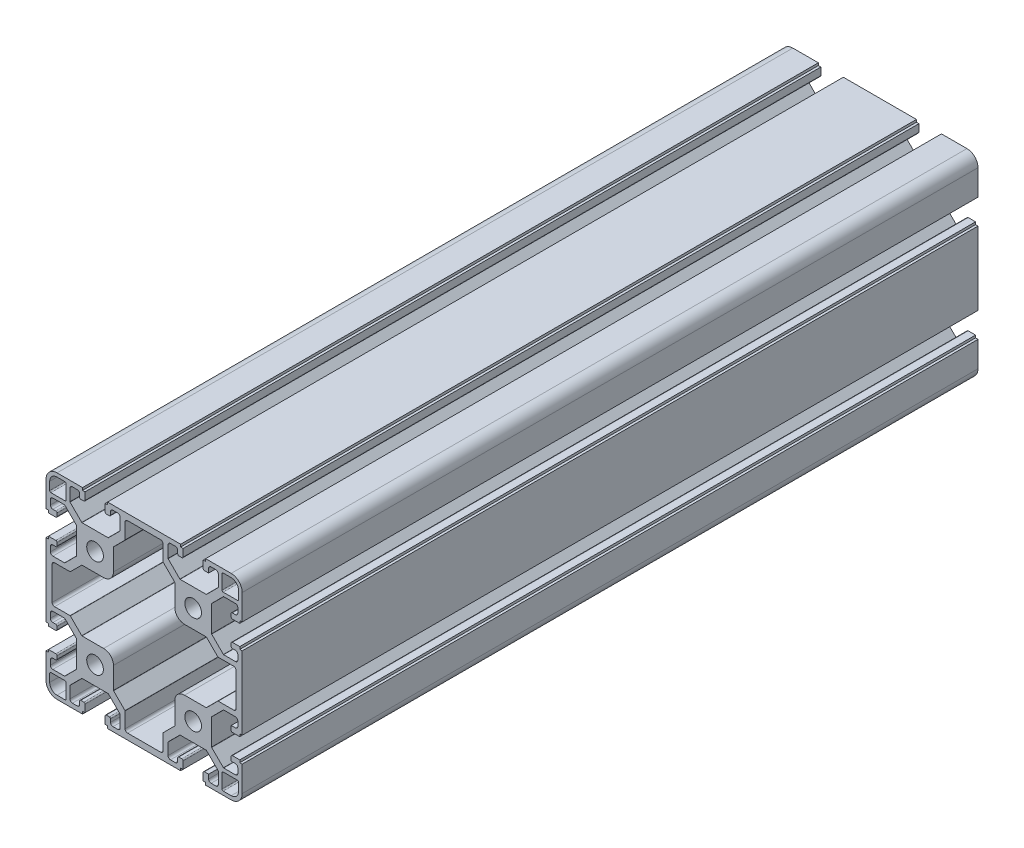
SolidWorks part; units mm, degrees
ref_plane "前视基准面" through (0, 0, 0) normal (0, 0, 1) x (1, 0, 0)
ref_plane "上视基准面" through (0, 0, 0) normal (0, 1, 0) x (1, 0, 0)
ref_plane "右视基准面" through (0, 0, 0) normal (1, 0, 0) x (0, 0, -1)
sketch "草图1"
sketch_block_instance "A$C5842703E-1"
sketch_block "A$C5842703E"
extrude "凸台-拉伸1" add sketch "草图1" along normal mid plane 300
